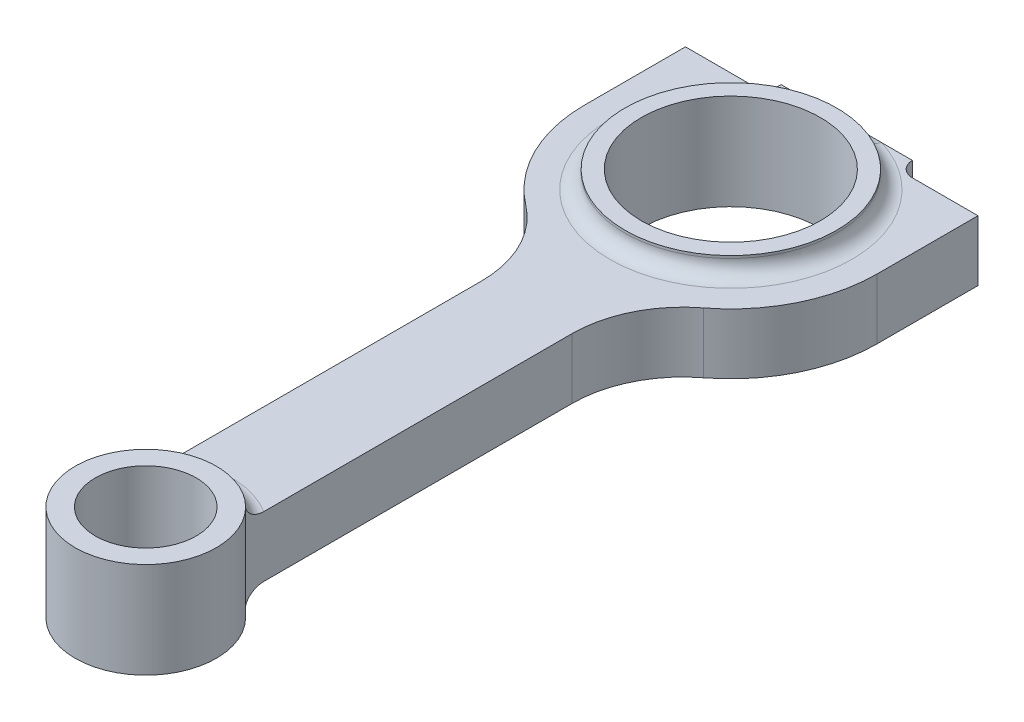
SolidWorks part; units mm, degrees
ref_plane "Front Plane" through (0, 0, 0) normal (0, 0, 1) x (1, 0, 0)
ref_plane "Top Plane" through (0, 0, 0) normal (0, 1, 0) x (1, 0, 0)
ref_plane "Right Plane" through (0, 0, 0) normal (1, 0, 0) x (0, 0, -1)
sketch "Sketch1" plane through (0, 0, 0) normal (0, 1, 0) x (1, 0, 0)
  line L0 (0, 0) -> (0, -116) construction
  line L1 (29, 0) -> (29, 20)
  line L2 (29, 20) -> (13, 20)
  line L3 (13, 20) -> (13, 23)
  line L4 (13, 23) -> (-13, 23)
  line L5 (9, -105.2762) -> (9, -40.4969)
  line L6 (-9, -105.2762) -> (-9, -40.4969)
  line L7 (-13, 20) -> (-13, 23)
  line L8 (-29, 20) -> (-13, 20)
  line L9 (-29, 0) -> (-29, 20)
  circle A0 centre (0, 0) radius 17.75
  arc A1 (17.6275, -23.0277) -> (29, 0) centre (0, 0) ccw
  circle A3 centre (0, -116) radius 10
  arc A4 (-9, -105.2762) -> (9, -105.2762) centre (0, -116) ccw
  arc A5 (17.6275, -23.0277) -> (9, -40.4969) centre (31, -40.4969) ccw
  arc A6 (-17.6275, -23.0277) -> (-9, -40.4969) centre (-31, -40.4969) cw
  arc A7 (-17.6275, -23.0277) -> (-29, 0) centre (0, 0) cw
  point P4 (0, 23)
  point P15 (0, 0)
  point P16 (0, 0)
  dimension "D2" = 17.75
  dimension "D3" = 29
  dimension "D7" = 14
  dimension "D8" = 10
  dimension "D10" = 22
  dimension "D1" = 116
  dimension "D4" = 20
  dimension "D5" = 16
  dimension "D6" = 3
  dimension "D9" = 9
extrude "Boss-Extrude1" add sketch "Sketch1" along normal mid plane 12
sketch "Sketch3" plane through (0, 0, 0) normal (0, 1, 0) x (1, 0, 0)
  circle A0 centre (0, -116) radius 10
  circle A1 centre (0, -116) radius 14
  dimension "D1" = 28
  dimension "D2" = 20
extrude "Boss-Extrude3" add sketch "Sketch3" along normal mid plane 19
sketch "Sketch4" plane through (0, 0, 0) normal (0, 1, 0) x (1, 0, 0)
  circle A0 centre (0, 0) radius 17.75
  circle A1 centre (0, 0) radius 21
  dimension "D1" = 35.5
  dimension "D2" = 42
extrude "Boss-Extrude4" add sketch "Sketch4" along normal mid plane 19
fillet "Fillet1" radius 3 6 edges at (0, -6, 102) (0, 6, 102) (13, 0, -20) (-13, 0, -20) (0, -6, 21) (0, 6, 21)
